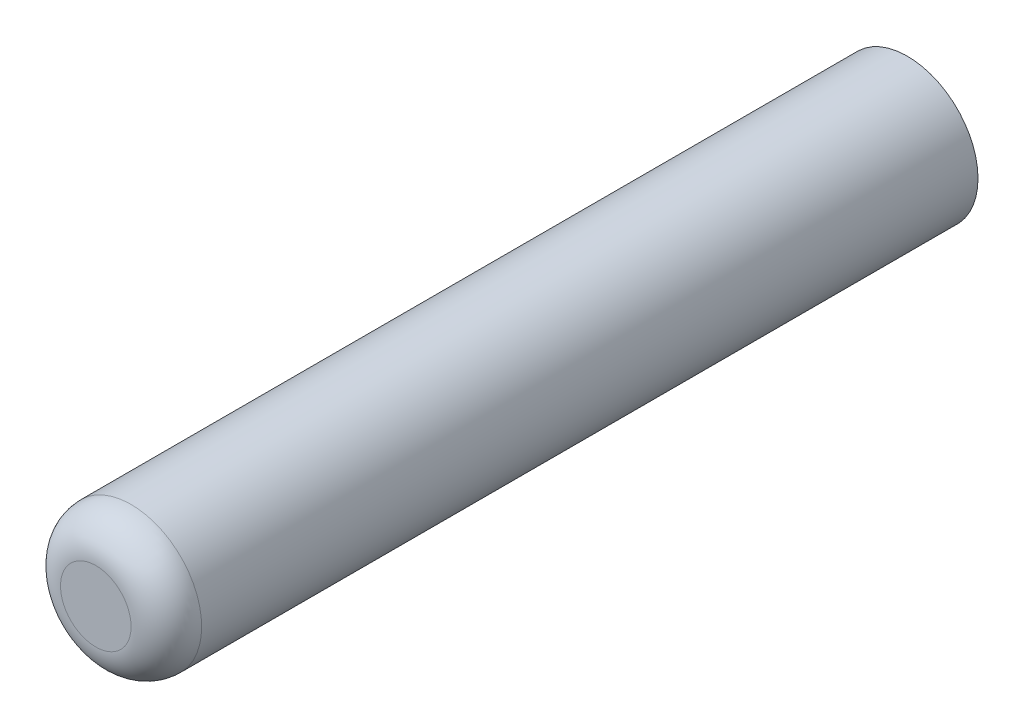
SolidWorks part; units mm, degrees
ref_plane "Face" through (0, 0, 0) normal (0, 0, 1) x (1, 0, 0)
ref_plane "Dessus" through (0, 0, 0) normal (0, 1, 0) x (1, 0, 0)
ref_plane "Droite" through (0, 0, 0) normal (1, 0, 0) x (0, 0, -1)
sketch "Esquisse1" plane through (0, 0, 0) normal (0, 0, 1) x (1, 0, 0)
  circle A0 centre (0, 0) radius 1
  dimension "D1" = 2
extrude "Axe" add sketch "Esquisse1" along normal mid plane 11.5
fillet "Congé" radius 0.5
